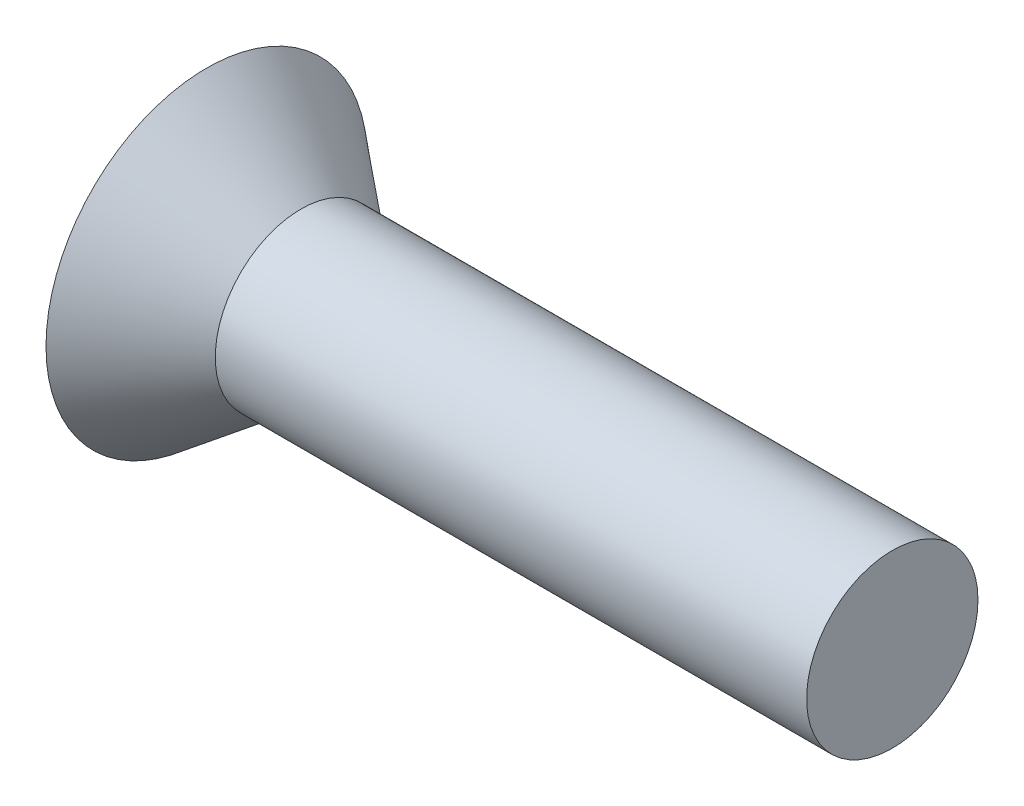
SolidWorks part; units mm, degrees
ref_plane "Front Plane" through (0, 0, 0) normal (0, 0, 1) x (1, 0, 0)
ref_plane "Top Plane" through (0, 0, 0) normal (0, 1, 0) x (1, 0, 0)
ref_plane "Right Plane" through (0, 0, 0) normal (1, 0, 0) x (0, 0, -1)
sketch "Sketch1" plane through (0, 0, 0) normal (0, 0, 1) x (1, 0, 0)
  line L0 (0, 0) -> (-3.9488, 0) construction
  line L1 (0, 0) -> (0, 3.75)
  line L2 (0, 3.75) -> (2.2, 2)
  line L3 (2.2, 2) -> (16, 2)
  line L4 (16, 2) -> (16, 0)
  line L5 (16, 0) -> (0, 0)
  dimension "D1" = 7.5
  dimension "D2" = 4
  dimension "D3" = 2.2
  dimension "D4" = 16
revolve "Revolve1" add sketch "Sketch1" angle 360 about L0
